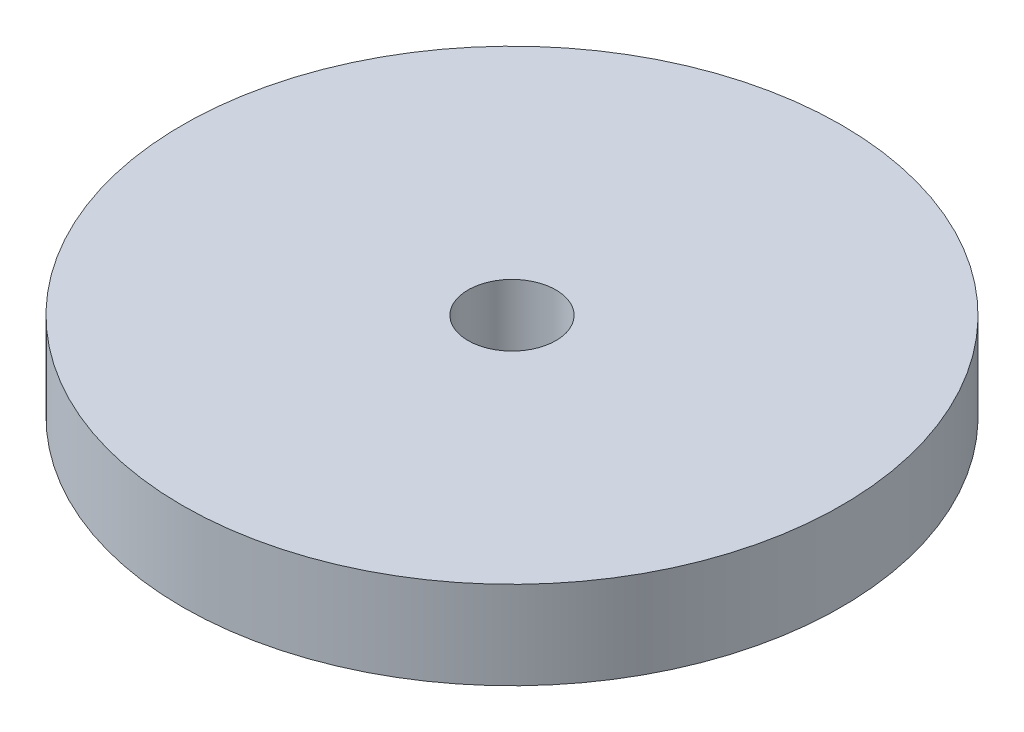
SolidWorks part; units mm, degrees
ref_plane "Front" through (0, 0, 0) normal (0, 0, 1) x (1, 0, 0)
ref_plane "Top" through (0, 0, 0) normal (0, 1, 0) x (1, 0, 0)
ref_plane "Right" through (0, 0, 0) normal (1, 0, 0) x (0, 0, -1)
sketch "Sketch1" plane through (0, 0, 0) normal (0, 1, 0) x (1, 0, 0)
  circle A0 centre (0, 0) radius 3
  circle A1 centre (0, 0) radius 22.5
extrude "Extrude1" add sketch "Sketch1" along normal blind 6
